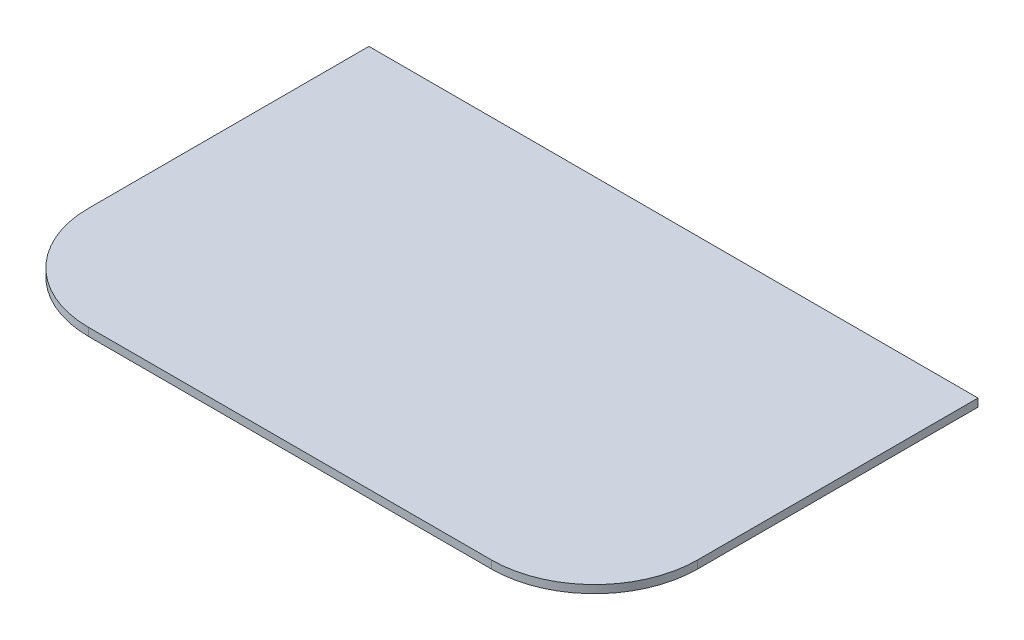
SolidWorks part; units mm, degrees
ref_plane "Front Plane" through (0, 0, 0) normal (0, 0, 1) x (1, 0, 0)
ref_plane "Top Plane" through (0, 0, 0) normal (0, 1, 0) x (1, 0, 0)
ref_plane "Right Plane" through (0, 0, 0) normal (1, 0, 0) x (0, 0, -1)
sketch "Sketch1" plane through (0, 0, 0) normal (0, 1, 0) x (1, 0, 0)
  line L0 (97.5836, 61.4375) -> (-97.5836, -61.4375) construction
  line L1 (-97.5836, 61.4375) -> (97.5836, 61.4375)
  line L2 (-97.5836, 61.4375) -> (-97.5836, -61.4375)
  line L3 (-97.5836, -61.4375) -> (97.5836, -61.4375)
  line L4 (97.5836, 61.4375) -> (97.5836, -61.4375)
extrude "Extrude1" add sketch "Sketch1" along normal blind 2.54
fillet "Fillet1" radius 33.02 2 edges at (97.5836, 1.27, 61.4375) (-97.5836, 1.27, 61.4375)
